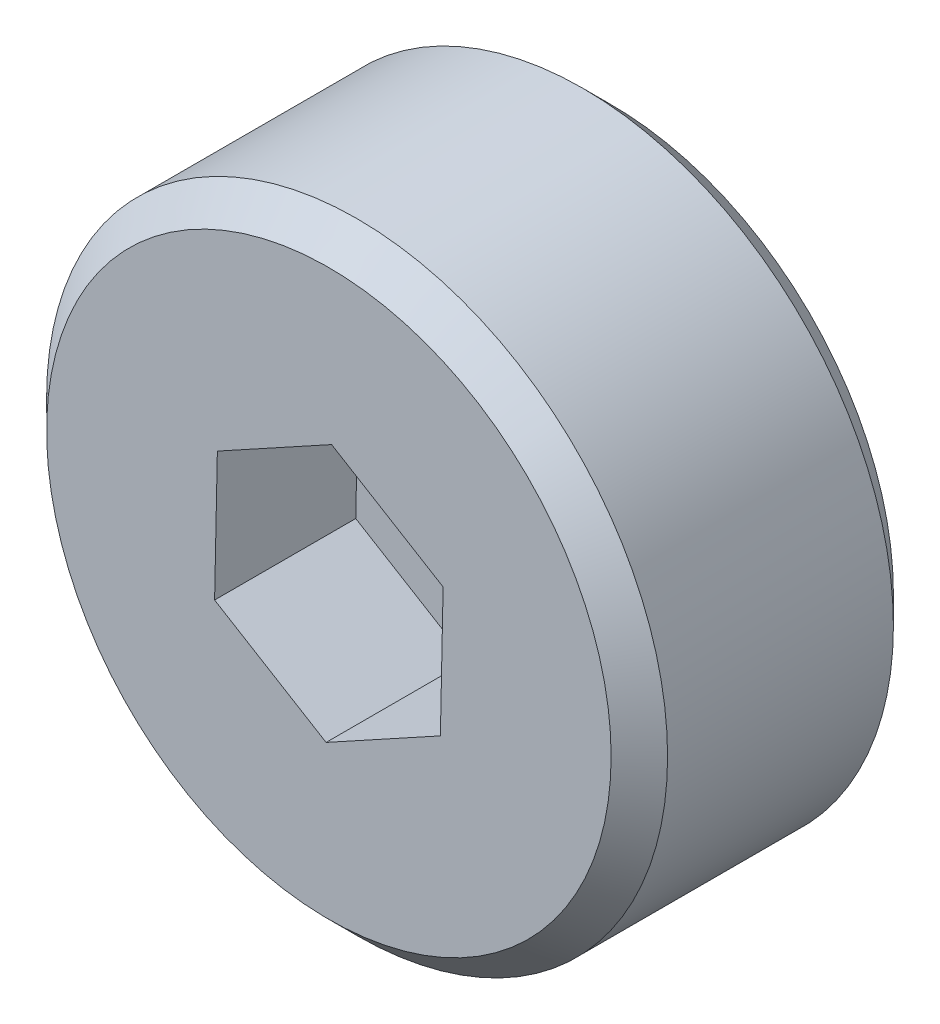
SolidWorks part; units mm, degrees
ref_plane "Alzado" through (0, 0, 0) normal (0, 0, 1) x (1, 0, 0)
ref_plane "Planta" through (0, 0, 0) normal (0, 1, 0) x (1, 0, 0)
ref_plane "Vista lateral" through (0, 0, 0) normal (1, 0, 0) x (0, 0, -1)
sketch "Croquis1" plane through (0, 0, 0) normal (0, 0, 1) x (1, 0, 0)
  circle A0 centre (0, 0) radius 11
  dimension "D1" = 22
extrude "Saliente-Extruir1" add sketch "Croquis1" along normal blind 10
sketch "Croquis2" plane through (0, 0, 10) normal (0, 0, 1) x (1, 0, 0)
  line L1 (-3.9503, 2.3933) -> (-4.0479, -2.2244)
  line L2 (-4.0479, -2.2244) -> (-0.0975, -4.6178)
  line L3 (-0.0975, -4.6178) -> (3.9503, -2.3933)
  line L4 (3.9503, -2.3933) -> (4.0479, 2.2244)
  line L5 (4.0479, 2.2244) -> (0.0975, 4.6178)
  line L6 (0.0975, 4.6178) -> (-3.9503, 2.3933)
  circle A0 centre (0, 0) radius 4 construction
  dimension "D1" = 8
extrude "Cortar-Extruir1" cut sketch "Croquis2" against normal blind 5
chamfer "Chaflán1" distance 1 angle 45 2 edges at (11, 0, 0) (11, 0, 10)
